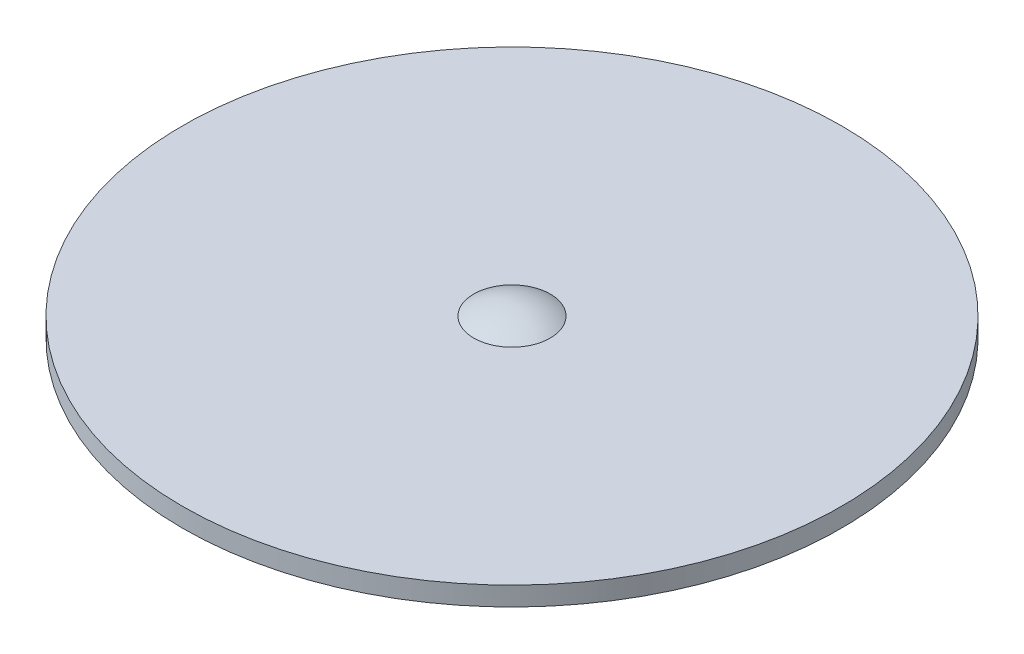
SolidWorks part; units mm, degrees
ref_plane "Front Plane" through (0, 0, 0) normal (0, 0, 1) x (1, 0, 0)
ref_plane "Top Plane" through (0, 0, 0) normal (0, 1, 0) x (1, 0, 0)
ref_plane "Right Plane" through (0, 0, 0) normal (1, 0, 0) x (0, 0, -1)
sketch "Sketch2" plane through (0, 0, 0) normal (0, 0, 1) x (1, 0, 0)
  line L0 (-15.875, 0) -> (-1.8415, 0)
  line L1 (0, 0) -> (0, -10.0727) construction
  line L3 (-15.875, -0.9144) -> (-1.5691, -0.9144)
  line L5 (-15.875, 0) -> (-15.875, -0.9144)
  line L7 (0, 0.508) -> (0, -0.4064)
  line L8 (1.5691, -0.9144) -> (15.875, -0.9144) construction
  line L9 (1.8415, 0) -> (15.875, 0) construction
  arc A0 (-1.8415, 0) -> (0, 0.508) centre (0, -3.0837) cw
  arc A1 (-1.5691, -0.9144) -> (0, -0.4064) centre (0, -3.0837) cw
  arc A2 (-1.5691, -0.9144) -> (1.5691, -0.9144) centre (0, -3.0837) cw construction
  arc A3 (-1.8415, 0) -> (1.8415, 0) centre (0, -3.0837) cw construction
  dimension "D2" = 0.508
  dimension "D1" = 1.8415
  dimension "D4" = 0.9144
revolve "Revolve2" add sketch "Sketch2" angle 360 about L1
